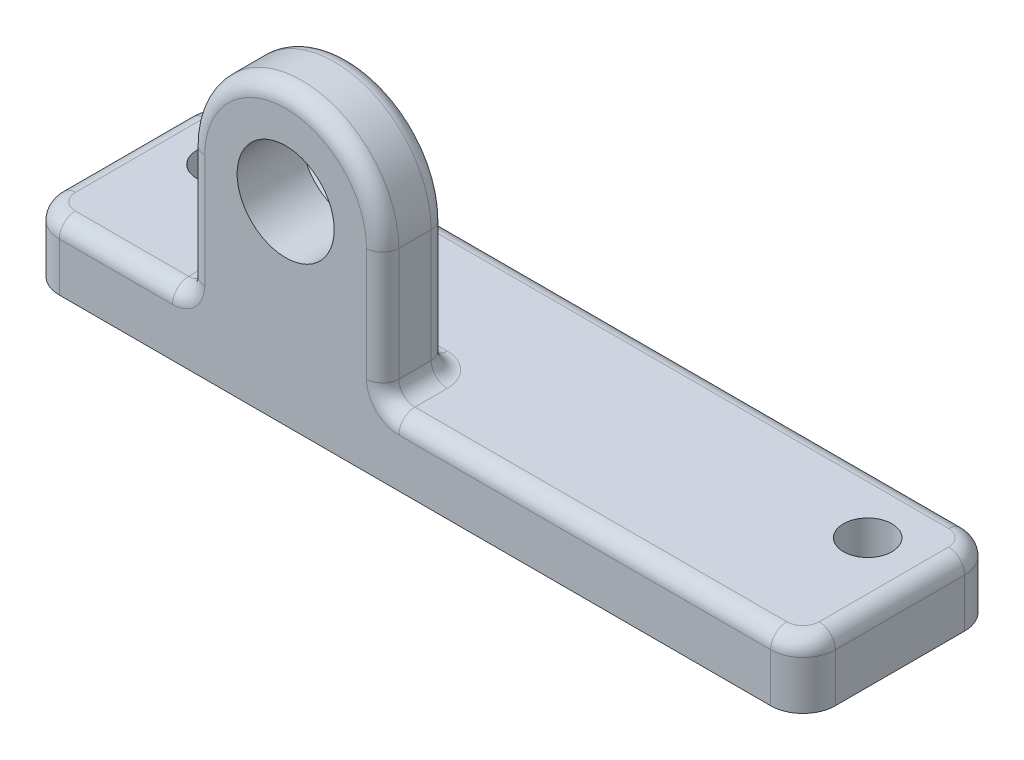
SolidWorks part; units mm, degrees
ref_plane "Plane1" through (0, 0, 0) normal (0, 0, 1) x (1, 0, 0)
ref_plane "Plane2" through (0, 0, 0) normal (0, 1, 0) x (1, 0, 0)
ref_plane "Plane3" through (0, 0, 0) normal (1, 0, 0) x (0, 0, -1)
sketch "Sketch1" plane through (0, 0, 0) normal (0, 1, 0) x (1, 0, 0)
  line L1 (0, 0) -> (152.4, 0)
  line L2 (0, 0) -> (0, 38.1)
  line L3 (0, 38.1) -> (152.4, 38.1)
  line L4 (152.4, 0) -> (152.4, 38.1)
  dimension "D1" = 152.4
  dimension "D2" = 38.1
extrude "Base Plate" add sketch "Sketch1" along normal blind 12.7
sketch "Sketch2" plane through (0, 0, 0) normal (0, 0, 1) x (1, 0, 0)
  line L0 (31.75, 0) -> (31.75, 38.1)
  line L1 (0, 0) -> (152.4, 0) construction
  line L2 (69.85, 38.1) -> (69.85, 0)
  line L3 (69.85, 0) -> (31.75, 0)
  line L4 (0, 12.7) -> (0, 0) construction
  arc A0 (31.75, 38.1) -> (69.85, 38.1) centre (50.8, 38.1) cw
  dimension "D1" = 19.05
  dimension "D2" = 38.1
  dimension "D3" = 50.8
extrude "Vert_boss" add sketch "Sketch2" against normal blind 12.7
hole_wizard "3/4 (0.75) Diameter Hole1" positions "Sketch6" profile "Sketch5" hole size "3/4" standard "Ansi Inch"
sketch "Sketch6" plane through (0, 0, 0) normal (0, 0, 1) x (1, 0, 0)
  point P0 (50.8, 38.1)
sketch "Sketch5" plane through (50.8, 38.1, 0) normal (1, 0, 0) x (0, -1, 0)
  line L0 (0, 0) -> (0, 38.1)
  line L1 (0, 38.1) -> (9.525, 38.1)
  line L2 (9.525, 38.1) -> (9.525, 0)
  line L5 (9.525, 0) -> (0, 0)
  line L11 (0, -6.35) -> (0, 107.95) construction
  dimension "Thru Hole Dia." = 19.05
  dimension "Thru Hole Depth" = 38.1
hole_wizard "3/8 (0.375) Diameter Hole1" positions "Sketch8" profile "Sketch7" hole size "3/8" standard "Ansi Inch"
sketch "Sketch8" plane through (0, 12.7, 0) normal (0, 1, 0) x (-1, 0, 0)
  line L0 (-152.4, 0) -> (-152.4, -38.1) construction
  line L1 (-152.4, -38.1) -> (0, -38.1) construction
  line L2 (0, -38.1) -> (0, 0) construction
  point P0 (-139.7, -25.4)
  point P1 (-12.7, -25.4)
  dimension "D1" = 12.7
  dimension "D2" = 12.7
  dimension "D3" = 12.7
sketch "Sketch7" plane through (139.7, 12.7, -25.4) normal (1, 0, 0) x (0, 0, 1)
  line L0 (0, 0) -> (0, 12.7)
  line L1 (0, 12.7) -> (4.7625, 12.7)
  line L2 (4.7625, 12.7) -> (4.7625, 0)
  line L5 (4.7625, 0) -> (0, 0)
  line L11 (0, -6.35) -> (0, 107.95) construction
  dimension "Thru Hole Dia." = 9.525
  dimension "Thru Hole Depth" = 12.7
fillet "Fillet1" radius 6.35 4 edges at (0, 6.35, -38.1) (152.4, 6.35, -38.1) (152.4, 6.35, 0) (0, 6.35, 0)
fillet "Fillet2" radius 3.175 18 edges at (107.95, 12.7, 0) (31.75, 25.4, -12.7) (69.85, 25.4, -12.7) (31.75, 25.4, 0) (69.85, 25.4, 0) (50.8, 57.15, 0) (31.75, 12.7, -6.35) (50.8, 57.15, -12.7) (69.85, 12.7, -6.35) (50.8, 12.7, -12.7) (19.05, 12.7, 0) (0, 12.7, -19.05) (152.4, 12.7, -19.05) (76.2, 12.7, -38.1) (150.5401, 12.7, -36.2401) (150.5401, 12.7, -1.8599) (1.8599, 12.7, -36.2401) (1.8599, 12.7, -1.8599)
